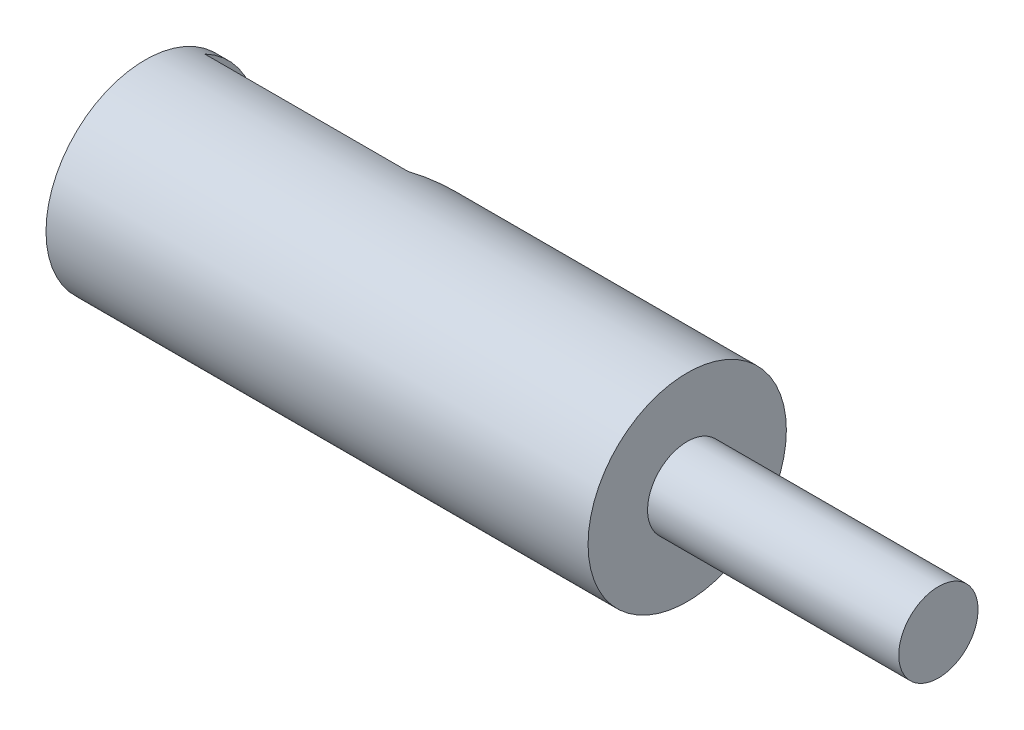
SolidWorks part; units mm, degrees
ref_plane "Plan1" through (0, 0, 0) normal (0, 0, 1) x (1, 0, 0)
ref_plane "Plan2" through (0, 0, 0) normal (0, 1, 0) x (1, 0, 0)
ref_plane "Plan3" through (0, 0, 0) normal (1, 0, 0) x (0, 0, -1)
sketch "Esquisse1" plane through (0, 0, 0) normal (0, 0, 1) x (1, 0, 0)
  line L0 (-120, 0) -> (140, 0) construction
  line L1 (-80, 7.5) -> (-39, 7.5)
  line L2 (-80, 7.5) -> (-80, 5)
  line L3 (-39, 7.5) -> (-39, 3)
  line L4 (-39, 3) -> (-20, 3)
  line L5 (-20, 3) -> (-20, 0)
  line L6 (-80, 5) -> (-79, 5)
  line L7 (-20, 0) -> (-41, 0)
  line L8 (-41, 5) -> (-41, 0)
  line L9 (-79, 6) -> (-79, 5)
  line L11 (-79, 6) -> (-76, 6)
  line L12 (-76, 5) -> (-41, 5)
  line L13 (-76, 6) -> (-76, 5)
  dimension "D1" = 7.5
  dimension "D2" = 41
  dimension "D3" = 3
  dimension "D4" = 19
  dimension "D5" = 5
  dimension "D6" = 2
  dimension "D7" = 1
  dimension "D9" = 1
revolve "Base-Révolution" add sketch "Esquisse1" angle 360 about L0
ref_plane "Plan5" through (0, 0, -7.5) normal (0, 0, 1) x (1, 0, 0)
sketch "Esquisse2" plane through (0, 0, -7.5) normal (0, 0, 1) x (1, 0, 0)
  line L0 (-79, 7.5) -> (-79, -7.5)
  line L2 (-39, 7.5) -> (-80, 7.5) construction
  line L4 (-80, -7.5) -> (-39, -7.5) construction
  line L5 (-79, 7.5) -> (-67, 7.5)
  line L7 (-80, 7.5) -> (-80, -7.5) construction
  line L8 (-60, 0.5) -> (-60, -0.5)
  line L9 (-79, -7.5) -> (-67, -7.5)
  arc A0 (-60, 0.5) -> (-67, 7.5) centre (-67, 0.5) ccw
  arc A1 (-60, -0.5) -> (-67, -7.5) centre (-67, -0.5) cw
  dimension "D2" = 19
  dimension "D3" = 7
  dimension "D1" = 1
extrude "Enlèv. mat.-Extru.5" cut sketch "Esquisse2" along normal blind 4
sketch "Esquisse3" plane through (0, 0, 0) normal (0, 1, 0) x (1, 0, 0)
  line L0 (-71, 10) -> (-71, -10) construction
  line L1 (-76, 3.5) -> (-76, -6) construction
  dimension "D1" = 5
